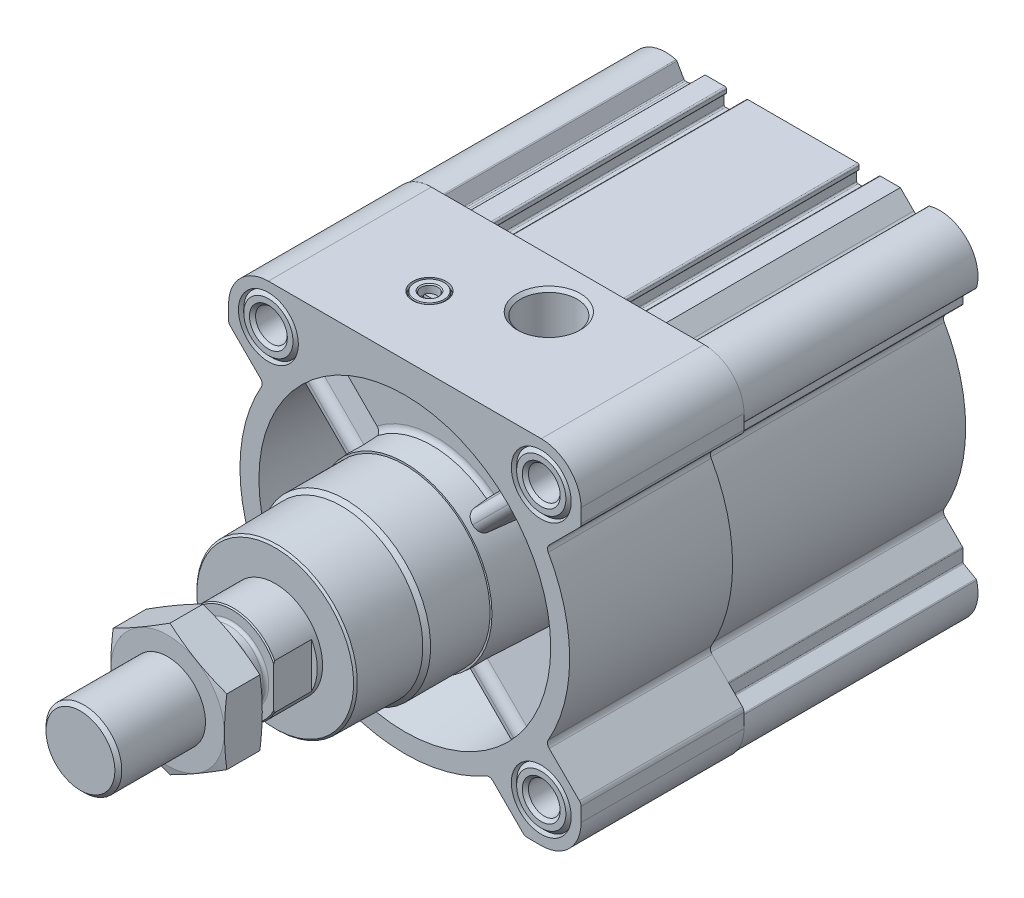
SolidWorks part; units mm, degrees
ref_plane "Plano frontal" through (0, 0, 0) normal (0, 0, 1) x (1, 0, 0)
ref_plane "Plano superior" through (0, 0, 0) normal (0, 1, 0) x (1, 0, 0)
ref_plane "Plano direito" through (0, 0, 0) normal (1, 0, 0) x (0, 0, -1)
imported_body "1"
imported_body "2"
imported_body "3"
sketch "Esboço2" plane through (0, 0, -182) normal (0, 0, -1) x (-1, 0, 0)
  circle A0 centre (0, 0) radius 73.3715
extrude "Corte-extrusão1" cut sketch "Esboço2" against normal blind 77
sketch "Esboço3" plane through (0, 0, -135) normal (0, 0, -1) x (-1, 0, 0)
  circle A0 centre (0, 0) radius 45.169
extrude "Corte-extrusão2" cut sketch "Esboço3" against normal blind 27
